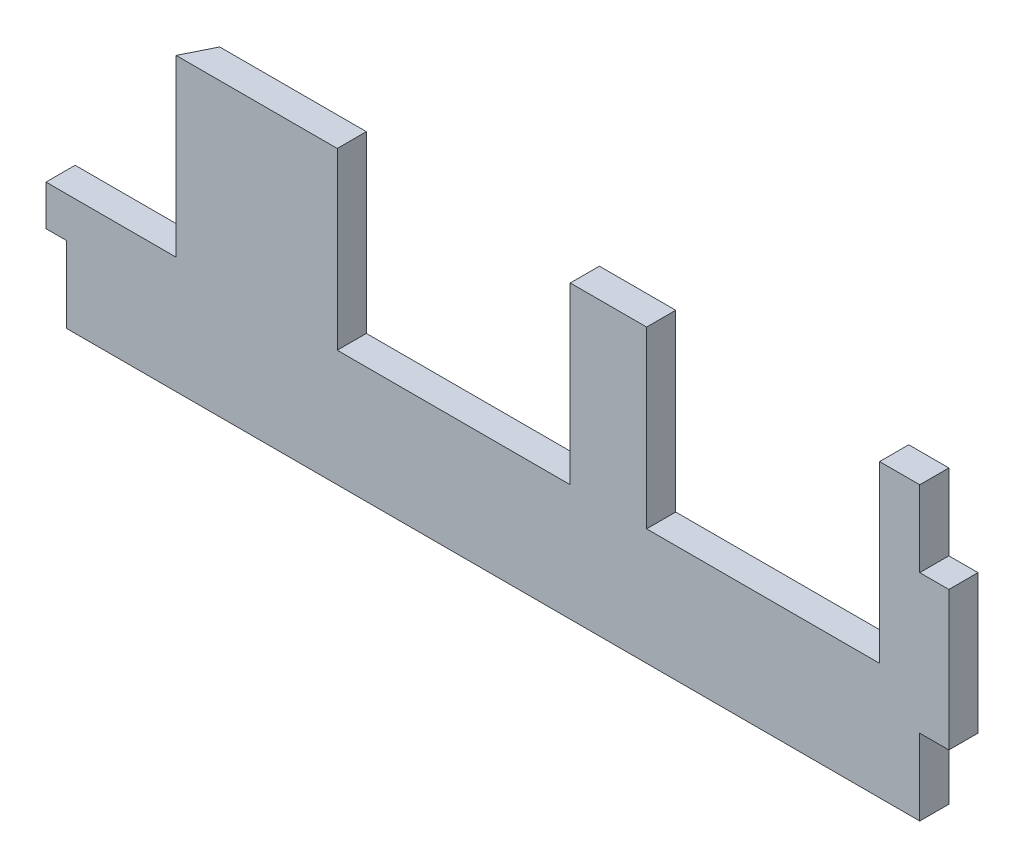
SolidWorks part; units mm, degrees
ref_plane "Front Plane" through (0, 0, 0) normal (0, 0, 1) x (1, 0, 0)
ref_plane "Top Plane" through (0, 0, 0) normal (0, 1, 0) x (1, 0, 0)
ref_plane "Right Plane" through (0, 0, 0) normal (1, 0, 0) x (0, 0, -1)
sketch "Sketch1" plane through (0, 0, 0) normal (0, 0, 1) x (1, 0, 0)
  line L0 (-28.7548, 131.3792) -> (-28.7548, 98.1886) construction
  line L1 (-16.0548, 131.3792) -> (-28.7548, 131.3792) construction
  line L2 (-16.0548, 191.9981) -> (-16.0548, 131.3792) construction
  line L3 (-16.0548, 191.9981) -> (-28.7548, 191.9981) construction
  line L4 (-28.7548, 225.1886) -> (-28.7548, 191.9981) construction
  line L6 (-28.7548, 131.3792) -> (-28.7548, 98.1886)
  line L7 (-16.0548, 131.3792) -> (-28.7548, 131.3792)
  line L8 (-16.0548, 191.9981) -> (-16.0548, 131.3792)
  line L9 (-16.0548, 191.9981) -> (-28.7548, 191.9981)
  line L10 (-28.7548, 225.1886) -> (-28.7548, 191.9981)
  line L12 (-409.7548, 131.3792) -> (-409.7548, 148.9886) construction
  line L15 (-409.7548, 131.3792) -> (-409.7548, 225.1886)
  line L18 (-400.7745, 98.1886) -> (-400.7745, 131.3792) construction
  line L20 (-400.7745, 98.1886) -> (-400.7745, 131.3792)
  line L21 (-400.7745, 98.1886) -> (-28.7548, 98.1886)
  line L22 (-400.7745, 131.3792) -> (-409.7548, 131.3792) construction
  line L23 (-400.7745, 131.3792) -> (-409.7548, 131.3792)
  line L24 (-46.264, 225.1886) -> (-16.0548, 225.1886) construction
  line L25 (-409.7548, 225.1886) -> (-28.7548, 225.1886)
extrude "Extrude1" add sketch "Sketch1" against normal blind 12.7
sketch "Sketch2" plane through (0, 225.1886, 0) normal (0, 1, 0) x (1, 0, 0)
  line L0 (-28.7548, 12.7) -> (-409.7548, 12.7) construction
  line L1 (-282.7548, 12.7) -> (-181.1548, 12.7)
  line L2 (-282.7548, 12.7) -> (-282.7548, 0)
  line L3 (-282.7548, 0) -> (-181.1548, 0)
  line L4 (-181.1548, 12.7) -> (-181.1548, 0)
  line L5 (-28.7548, 0) -> (-409.7548, 0) construction
  line L6 (-409.7548, 12.7) -> (-409.7548, 0)
  line L7 (-147.864, 12.7) -> (-46.264, 12.7)
  line L8 (-147.864, 12.7) -> (-147.864, 0)
  line L9 (-147.864, 0) -> (-46.264, 0)
  line L10 (-46.264, 12.7) -> (-46.264, 0)
  line L11 (-409.7548, 0) -> (-353.0253, 0)
  line L12 (-353.0253, 0) -> (-346.7127, 12.7)
  line L13 (-346.7127, 12.7) -> (-409.7548, 12.7)
  line L14 (-353.0253, 0) -> (-326.1644, 54.04) construction
  line L15 (-181.1548, 0) -> (-181.1548, 76.6513) construction
  line L16 (-46.264, 0) -> (-46.264, 76.2) construction
  line L17 (-147.864, 76.2) -> (-147.864, 0) construction
  line L18 (-282.7548, 76.6513) -> (-282.7548, 0) construction
extrude "Cut-Extrude1" cut sketch "Sketch2" against normal blind 76.2
